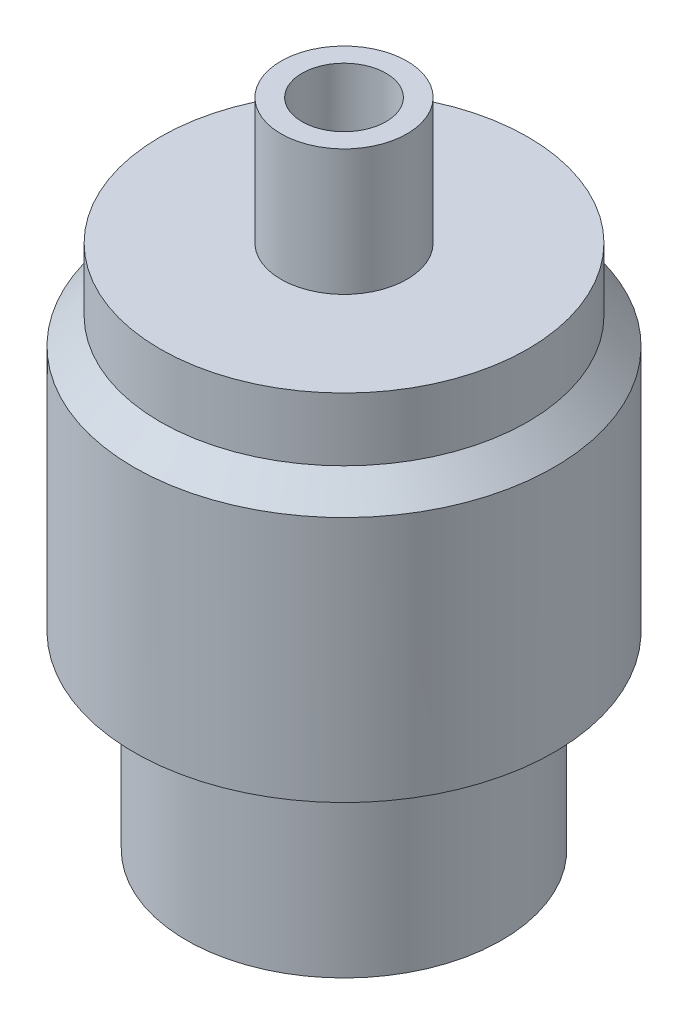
SolidWorks part; units mm, degrees
ref_plane "Přední rovina" through (0, 0, 0) normal (0, 0, 1) x (1, 0, 0)
ref_plane "Horní rovina" through (0, 0, 0) normal (0, 1, 0) x (1, 0, 0)
ref_plane "Pravá rovina" through (0, 0, 0) normal (1, 0, 0) x (0, 0, -1)
sketch "Skica1" plane through (0, 0, 0) normal (0, 1, 0) x (1, 0, 0)
  circle A0 centre (0, 0) radius 10
extrude "Přidat vysunutím1" add sketch "Skica1" along normal blind 25
sketch "Skica2" plane through (0, 25, 0) normal (0, 1, 0) x (1, 0, 0)
  circle A0 centre (0, 0) radius 8.75
  dimension "D1" = 17.5
extrude "Odebrat vysunutím1" cut sketch "Skica2" against normal blind 3 flip side to cut
sketch "Skica3" plane through (0, 25, 0) normal (0, 1, 0) x (1, 0, 0)
  circle A0 centre (0, 0) radius 3
extrude "Přidat vysunutím2" add sketch "Skica3" along normal blind 6
sketch "Skica4" plane through (0, 0, 0) normal (0, -1, 0) x (1, 0, 0)
  circle A0 centre (0, 0) radius 7.5
extrude "Odebrat vysunutím2" cut sketch "Skica4" against normal blind 7.5 flip side to cut
chamfer "Zkosení1" distance 1.5 distance2 2.5 1 edges at (0, 7.5, -10)
chamfer "Zkosení2" distance 1.25 angle 45 1 edges at (0, 22, 10)
hole_wizard "Ø7.0 (7) průměr díry1" positions "Skica6" profile "Skica5" hole size "Ø7.0" standard "DIN"
sketch "Skica6" plane through (0, 0, 0) normal (0, -1, 0) x (1, 0, 0)
  circle A0 centre (0, 0) radius 7.5 construction
  point P0 (0, 0)
  dimension "D1" = 0
sketch "Skica5" plane through (0, 0, 0) normal (1, 0, 0) x (0, 0, -1)
  line L0 (0, 0) -> (0, 22.0207)
  line L1 (0, 22.0207) -> (3.5, 20)
  line L2 (3.5, 20) -> (3.5, 0)
  line L5 (3.5, 0) -> (0, 0)
  line L10 (0, 22.0207) -> (-3.5, 20) construction
  line L11 (0, -6.35) -> (0, 107.95) construction
  dimension "Průměr díry" = 7
  dimension "Hloubka díry" = 20
  dimension "Úhel vrtání" = 120
sketch "Skica7" plane through (0, 31, 0) normal (0, 1, 0) x (1, 0, 0)
  circle A0 centre (0, 0) radius 2
extrude "Odebrat vysunutím3" cut sketch "Skica7" against normal through all
